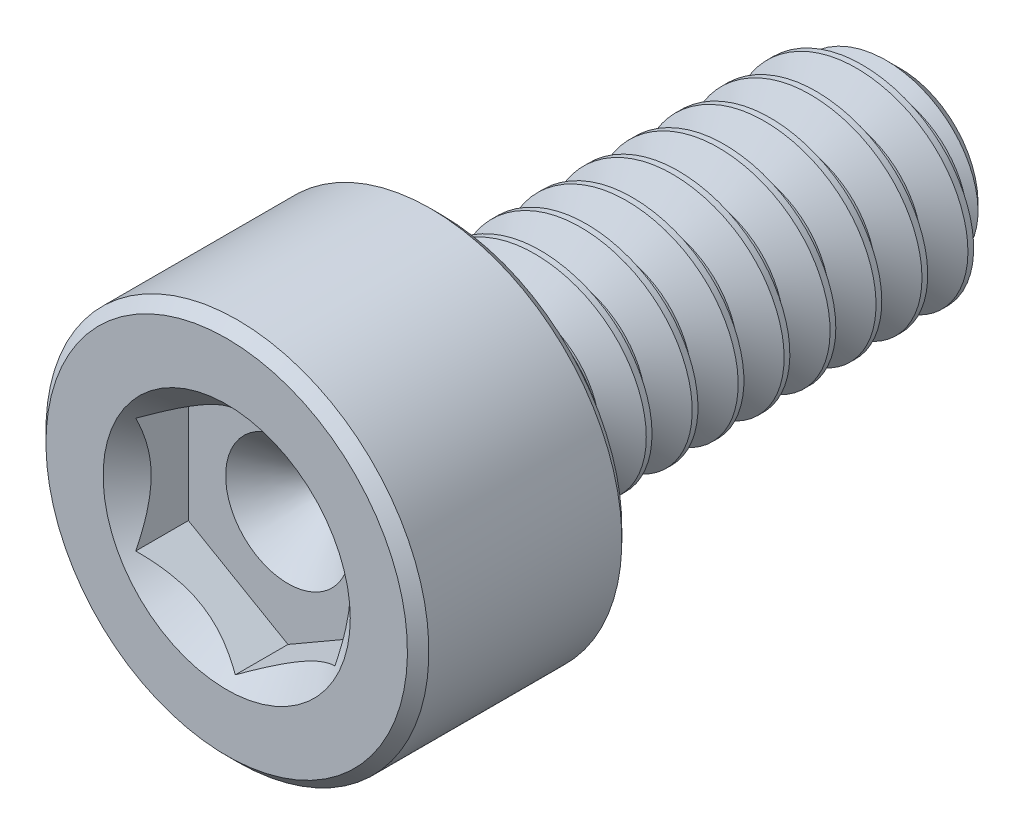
SolidWorks part; units mm, degrees
ref_plane "Front Plane" through (0, 0, 0) normal (0, 0, 1) x (1, 0, 0)
ref_plane "Top Plane" through (0, 0, 0) normal (0, 1, 0) x (1, 0, 0)
ref_plane "Right Plane" through (0, 0, 0) normal (1, 0, 0) x (0, 0, -1)
sketch "Sketch1" plane through (0, 0, 0) normal (1, 0, 0) x (0, 0, -1)
  line L0 (-2.2, 0) -> (2.2, 0) construction
  line L1 (2.2, 0) -> (2.2, 0.5051) construction
  line L2 (2.2, 0.5051) -> (2.0051, 0.7) construction
  line L3 (2.0051, 0.7) -> (1.975, 0.7) construction
  line L4 (1.975, 0.7) -> (-0.8, 0.7) construction
  line L5 (-0.8, 0.7) -> (-0.8, 1.25) construction
  line L6 (-0.8, 1.25) -> (-2.2, 1.25) construction
  line L7 (-2.2, 1.25) -> (-2.2, 0) construction
  line L8 (2.2, 0.5051) -> (2.2, 0.7) construction
  line L9 (2.1812, 0.7325) -> (2.3312, 0.4727) construction
  line L10 (2.3312, 0.4727) -> (2.4812, 0.7325) construction
  line L11 (2.4812, 0.7325) -> (2.1812, 0.7325) construction
  line L12 (2.3312, 0.7325) -> (2.3312, 0.7) construction
  line L13 (2.3312, 0.4727) -> (2.3312, 0.5051) construction
  line L14 (2.3125, 0.5051) -> (2.35, 0.5051) construction
  line L15 (2.2, 0.7) -> (2.4625, 0.7) construction
  line L16 (2.1906, 0.7162) -> (2.4719, 0.7162) construction
  line L17 (2.2, 0) -> (2.2, -0.7) construction
  line L18 (-0.87, 1.25) -> (-0.8, 1.18) construction
  line L19 (-2.13, 1.25) -> (-2.2, 1.18) construction
  line L20 (-0.8, 0.7) -> (-0.8, 0) construction
  line L21 (-0.8, 0.35) -> (0.2, 0.35) construction
  line L22 (0.2, 0.35) -> (1.2, 0.35) construction
  line L23 (1.2, 0.35) -> (2.2, 0.35) construction
  line L24 (0.2, 0.35) -> (0.2, 0.7) construction
  line L25 (0.2, 0.7) -> (0.2, 1.25) construction
  line L26 (1.2, 0.35) -> (1.2, 1.25) construction
  point P0 (-2.2, 0.65)
  point P3 (1.45, 0.7)
  point P4 (0, 0)
  point P18 (1.2, 0.7)
  point P22 (2.3312, 0.5051)
  point P24 (1.975, 0.7)
  point P25 (2.3312, 0.7)
  point P28 (2.3312, 0.7162)
  point P29 (1.45, -0.7)
  point P30 (0.2, 0.7)
  point P31 (-1.5, 1.25)
  point P37 (-1.045, 1.25)
  point P38 (-2.095, 1.25)
  point P45 (0.2, 0.35)
  point P46 (1.2, 0.35)
sketch "Sketch2" plane through (0, 0, 0) normal (1, 0, 0) x (0, 0, -1)
  line L0 (-2.2, 0) -> (-2.2, 1.18)
  line L1 (-2.13, 1.25) -> (-0.87, 1.25)
  line L2 (-0.8, 1.18) -> (-0.8, 0.77)
  line L4 (2.0051, 0.7) -> (2.2, 0.5051)
  line L5 (2.2, 0.5051) -> (2.2, 0)
  line L6 (-0.8, 1.25) -> (-2.2, 1.25) construction
  line L7 (2.2, 0) -> (-2.2, 0)
  line L8 (-2.13, 1.25) -> (-2.2, 1.18) construction
  line L10 (-2.13, 1.25) -> (-2.2, 1.18)
  line L14 (-0.87, 1.25) -> (-0.8, 1.18) construction
  line L16 (-0.87, 1.25) -> (-0.8, 1.18)
  line L17 (-0.8, 0.7) -> (-0.8, 1.25) construction
  line L19 (-0.73, 0.7) -> (2.0051, 0.7)
  line L20 (1.975, 0.7) -> (-0.8, 0.7) construction
  arc A1 (-0.8, 0.77) -> (-0.73, 0.7) centre (-0.73, 0.77) ccw
revolve "Revolve1" add sketch "Sketch2" angle 360 about L7
sketch "Sketch3" plane through (0, 0, 2.2) normal (0, 0, 1) x (1, 0, 0)
  line L1 (0.65, -0.3753) -> (0.65, 0.3753)
  line L2 (0.65, 0.3753) -> (0, 0.7506)
  line L3 (0, 0.7506) -> (-0.65, 0.3753)
  line L4 (-0.65, 0.3753) -> (-0.65, -0.3753)
  line L5 (-0.65, -0.3753) -> (0, -0.7506)
  line L6 (0, -0.7506) -> (0.65, -0.3753)
  circle A0 centre (0, 0) radius 0.65 construction
  circle A1 centre (0, 0) radius 1.25 construction
  circle A2 centre (0, 0) radius 1.25 construction
  circle A3 centre (0, 0) radius 0.7506 construction
  point P13 (0, 0)
extrude "Cut-Extrude1" cut sketch "Sketch3" against normal offset from surface (0.4 mm away) 1
sketch "Sketch4" plane through (0, 0, 2.2) normal (0, 0, 1) x (1, 0, 0)
  circle A0 centre (0, 0) radius 0.8068
extrude "Cut-Extrude2" cut sketch "Sketch4" against normal up to vertex (0.7 mm away) draft 45
sketch "Sketch11" plane through (0, 0, 0) normal (1, 0, 0) x (0, 0, -1)
  line L0 (-2.2, 0) -> (2.2, 0) construction
  line L1 (-2.2, 0) -> (2.2, 0) construction
  line L2 (-0.2375, 0) -> (-0.2375, 0.7) construction
  line L3 (1.975, 0.7) -> (-0.8, 0.7) construction
  line L4 (1.6375, 0) -> (1.6375, 0.7) construction
  line L6 (2.2, 0.5051) -> (2.2, 0.7) construction
  point P2 (-0.2375, 0)
  point P3 (1.6375, 0)
sketch "Sketch6" plane through (0, 0, -2.2) normal (0, 0, -1) x (-1, 0, 0)
  circle A0 centre (0, 0) radius 0.7
curve "Helix/Spiral1"
sketch "Sketch10" plane through (0, 0, 0) normal (1, 0, 0) x (0, 0, -1)
  line L0 (-0.73, -1.25) -> (-0.73, 1.25)
  line L5 (-2.2, 0) -> (2.2, 0) construction
  line L6 (-0.73, 0.7) -> (-0.73, -0.7) construction
  point P3 (-0.73, 0)
split "Split1" trim tools "Sketch10" bodies to split 106 resulting bodies 114 115
sketch "Sketch7" plane through (0, 0, 0) normal (1, 0, 0) x (0, 0, -1)
  line L0 (2.1906, 0.7162) -> (2.4719, 0.7162)
  line L1 (2.4719, 0.7162) -> (2.35, 0.5051)
  line L2 (2.35, 0.5051) -> (2.3125, 0.5051)
  line L3 (2.3125, 0.5051) -> (2.1906, 0.7162)
sweep "Cut-Sweep1" cut profiles "Sketch7" path "Helix/Spiral1"
sketch "Sketch8" plane through (0, 0, 0) normal (1, 0, 0) x (0, 0, -1)
  line L0 (-0.8, 0) -> (-0.8, 0.7)
  line L1 (-0.73, -0.7) -> (-0.73, 0.7) construction
  line L2 (-0.8, 0.7) -> (-0.73, 0.7)
  line L4 (-0.73, 0.7) -> (-0.3259, 0)
  line L5 (-0.3259, 0) -> (-0.8, 0)
  line L6 (1.975, 0.7) -> (-0.8, 0.7) construction
  line L7 (-2.2, 0) -> (2.2, 0) construction
  dimension "D1" = 60
revolve "Revolve2" add sketch "Sketch8" angle 360 about L5
equation "\"D2@Sketch1\" = \"Thread Pitch@Sketch1\" / 8"
equation "\"D4@Helix/Spiral1\" = \"Thread Pitch@Sketch1\""
equation "\"D7@Sketch1\" = \"Head Height@Sketch1\" * .05"
equation "\"D8@Sketch1\"=\"D7@Sketch1\""
equation "\"D9@Sketch1\"=\"D7@Sketch1\""
equation "\"D10@Sketch1\"=\"D7@Sketch1\"/2"
equation "\"D11@Sketch1\"=\"D10@Sketch1\"*5"
equation "\"D4@Sketch1\"=\"Thread Pitch@Sketch1\"*2.5"
equation "\"D12@Sketch1\"=\"Thread Pitch@Sketch1\"*.75"
equation "\"D3@Helix/Spiral1\"=\"Length@Sketch1\"+\"Thread Pitch@Sketch1\""
equation "\"D3@Sketch2\"=\"Thread Dia@Sketch1\"*0.05"
equation "\"D1@Sketch11\"=\"Length@Sketch1\"*0.1875"
equation "\"D2@Sketch11\"=\"D1@Sketch11\""
equation "\"D1@Sketch4\"=\"D1@Sketch3\"*1.075"
